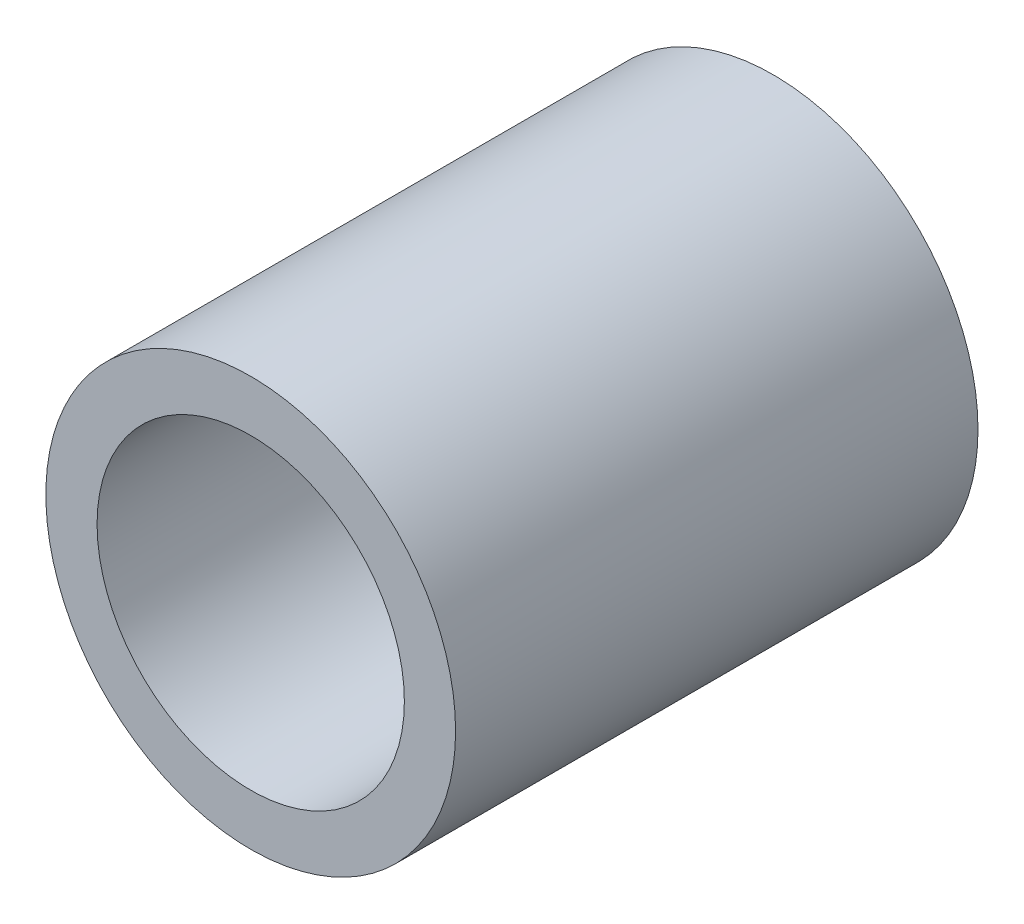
SolidWorks part; units mm, degrees
ref_plane "face" through (0, 0, 0) normal (0, 0, 1) x (1, 0, 0)
ref_plane "dessus" through (0, 0, 0) normal (0, 1, 0) x (1, 0, 0)
ref_plane "profil" through (0, 0, 0) normal (1, 0, 0) x (0, 0, -1)
sketch "Esquisse1" plane through (0, 0, 0) normal (0, 0, 1) x (1, 0, 0)
  circle A0 centre (0, 0) radius 7.5
  circle A1 centre (0, 0) radius 10
  dimension "D1" = 15
  dimension "D2" = 20
extrude "Base-Extrusion" add sketch "Esquisse1" along normal blind 25.5
